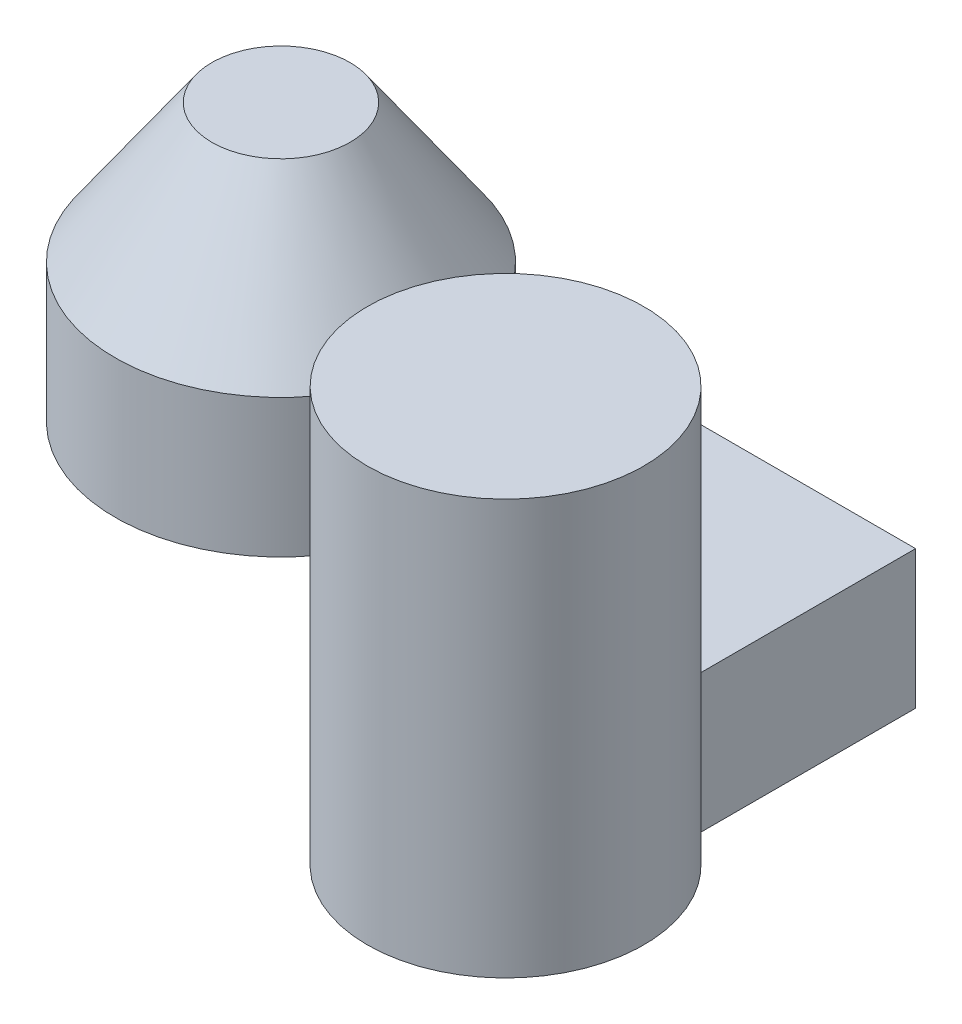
SolidWorks part; units mm, degrees
ref_plane "Front Plane" through (0, 0, 0) normal (0, 0, 1) x (1, 0, 0)
ref_plane "Top Plane" through (0, 0, 0) normal (0, 1, 0) x (1, 0, 0)
ref_plane "Right Plane" through (0, 0, 0) normal (1, 0, 0) x (0, 0, -1)
sketch "Sketch1" plane through (0, 0, 0) normal (1, 0, 0) x (0, 0, -1)
  line L0 (-6, 0) -> (-2.5, 5)
  line L1 (55, 0) -> (-55, 0) construction
  line L2 (-2.5, 5) -> (0, 5)
  line L3 (0, 55) -> (0, -55) construction
  line L4 (0, 5) -> (0, 0)
  line L5 (0, 0) -> (-6, 0)
  dimension "D1" = 2.5
  dimension "D2" = 6
  dimension "D3" = 5
revolve "Revolve1" add sketch "Sketch1" angle 360 about L4
sketch "Sketch2" plane through (0, 0, 0) normal (0, -1, 0) x (1, 0, 0)
  line L0 (5.4544, 2.5) -> (15.4544, 2.5)
  line L1 (5.4544, -2.5) -> (15.4544, -2.5)
  line L2 (15.4544, 2.5) -> (15.4544, 5.5)
  line L3 (15.4544, -2.5) -> (20.4544, -2.5)
  line L4 (20.4544, -2.5) -> (20.4544, 5.5)
  arc A0 (5.4544, 2.5) -> (5.4544, -2.5) centre (0, 0) ccw
  circle A1 centre (0, 0) radius 6 construction
  arc A2 (20.4544, 5.5) -> (15.4544, 5.5) centre (17.9544, 9.8301) ccw
  point P1 (0, 0)
  point P13 (21.9354, 10.172)
  point P14 (22.547, 16.6695)
  point P15 (5.473, 2.541)
  point P16 (0, 0)
  point P17 (0, 0)
  point P18 (0, 0)
  point P19 (5.964, -0.6563)
  point P20 (2.0016, -5.6563)
  point P21 (12.0016, -5.6563)
  point P22 (12.0016, -5.6563)
  dimension "D1" = 3
  dimension "D4" = 10
  dimension "D2" = 10
  dimension "D3" = 10
  dimension "D5" = 5
  dimension "D6" = 5
  dimension "D7" = 15
extrude "Boss-Extrude1" add sketch "Sketch2" along normal blind 5
sketch "Sketch4" plane through (0, 0, 0) normal (0, 1, 0) x (1, 0, 0)
  circle A0 centre (17.9544, -9.8301) radius 5
  dimension "D1" = 10
extrude "Boss-Extrude2" add sketch "Sketch4" along normal blind 10
